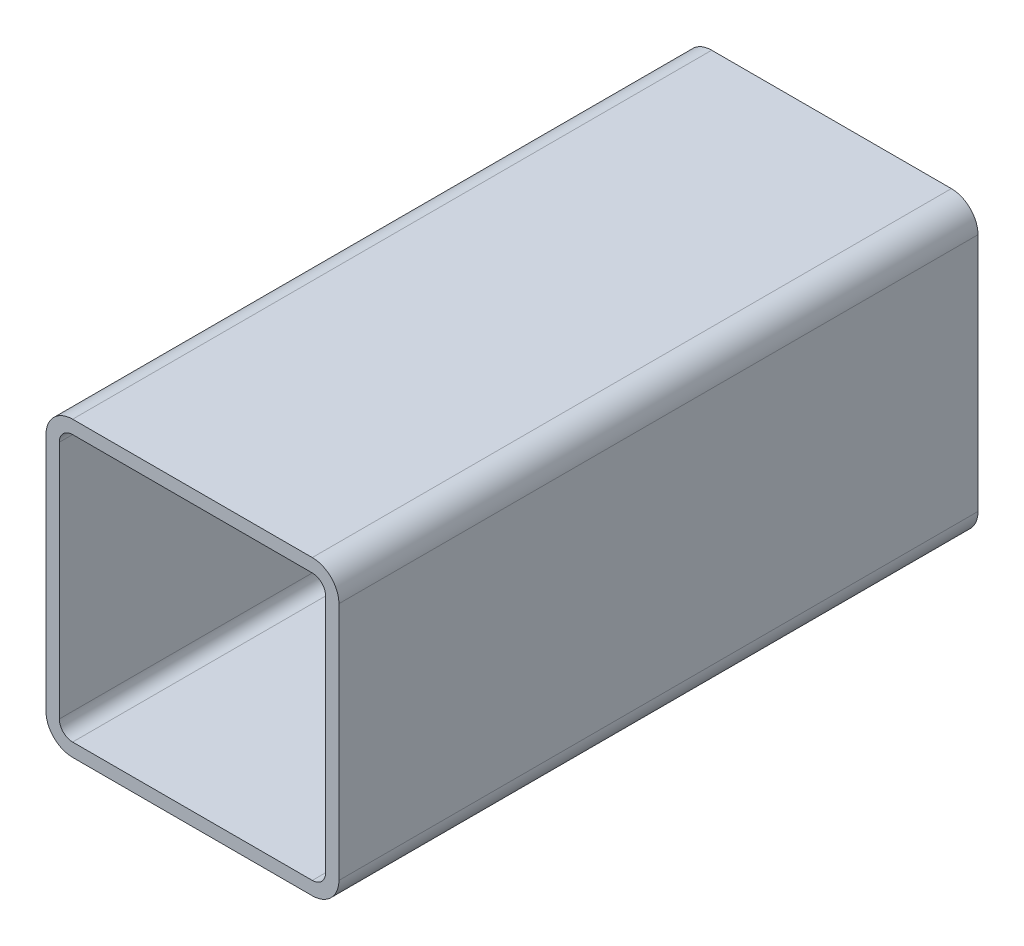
SolidWorks part; units mm, degrees
ref_plane "Front Plane" through (0, 0, 0) normal (0, 0, 1) x (1, 0, 0)
ref_plane "Top Plane" through (0, 0, 0) normal (0, 1, 0) x (1, 0, 0)
ref_plane "Right Plane" through (0, 0, 0) normal (1, 0, 0) x (0, 0, -1)
sketch "Sketch1" plane through (0, 0, 0) normal (0, 0, 1) x (1, 0, 0)
sketch_block_instance "HSS5.5x5.5x0.250-1"
sketch_block "HSS5.5x5.5x0.250"
extrude "Boss-Extrude1" add sketch "Sketch1" along normal blind 304.8
